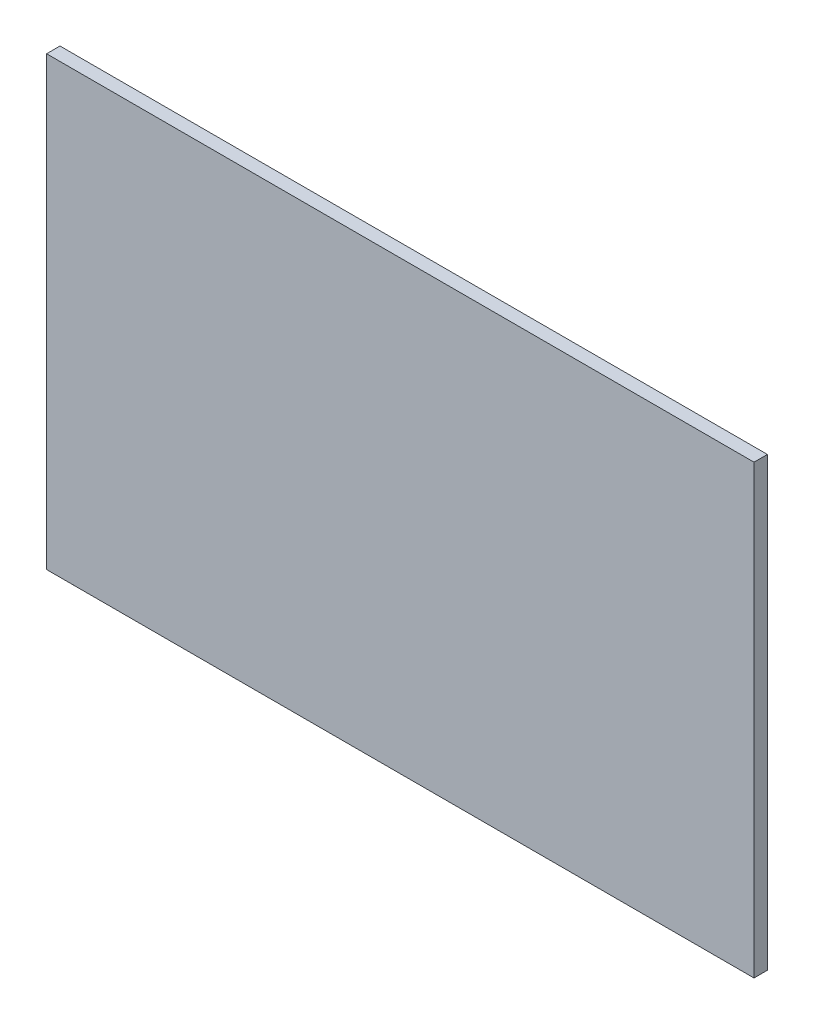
SolidWorks part; units mm, degrees
ref_plane "Front Plane" through (0, 0, 0) normal (0, 0, 1) x (1, 0, 0)
ref_plane "Top Plane" through (0, 0, 0) normal (0, 1, 0) x (1, 0, 0)
ref_plane "Right Plane" through (0, 0, 0) normal (1, 0, 0) x (0, 0, -1)
sketch "Sketch1" plane through (0, 0, 0) normal (0, 0, 1) x (1, 0, 0)
  line L1 (-79.18, -50) -> (79.18, -50)
  line L2 (-79.18, -50) -> (-79.18, 50)
  line L3 (-79.18, 50) -> (79.18, 50)
  line L4 (79.18, -50) -> (79.18, 50)
  line L5 (-79.18, -50) -> (79.18, 50) construction
  line L6 (-79.18, 50) -> (79.18, -50) construction
  point P0 (0, 0)
  dimension "D1" = 158.36
  dimension "D2" = 100
extrude "Boss-Extrude1" add sketch "Sketch1" along normal blind 3
